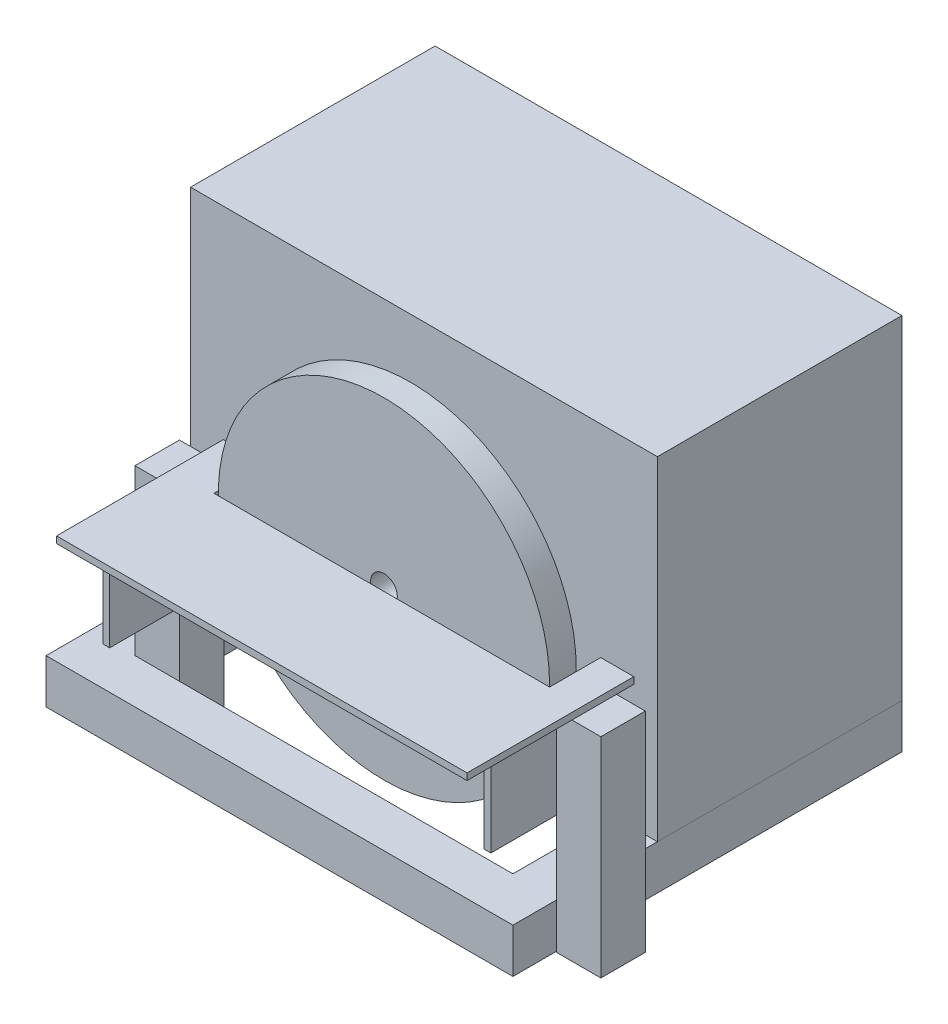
SolidWorks part; units mm, degrees
other "Tool Rest"
other "Plater"
other "Grinder Housing"
other "Base Frame"
ref_plane "Front Plane" through (0, 0, 0) normal (0, 0, 1) x (1, 0, 0)
ref_plane "Top Plane" through (0, 0, 0) normal (0, 1, 0) x (1, 0, 0)
ref_plane "Right Plane" through (0, 0, 0) normal (1, 0, 0) x (0, 0, -1)
sketch "Sketch1" plane through (0, 0, 0) normal (0, 1, 0) x (1, 0, 0)
  line L1 (-105, 87.5) -> (105, 87.5)
  line L2 (-105, 87.5) -> (-105, -87.5)
  line L3 (-105, -87.5) -> (105, -87.5)
  line L4 (105, 87.5) -> (105, -87.5)
  line L5 (-105, 87.5) -> (105, -87.5) construction
  line L6 (-105, -87.5) -> (105, 87.5) construction
  line L7 (85, 67.5) -> (85, -67.5)
  line L8 (-85, -67.5) -> (85, -67.5)
  line L9 (-85, 67.5) -> (-85, -67.5)
  line L10 (-85, 67.5) -> (85, 67.5) construction
  line L11 (-85, 67.5) -> (-85, 87.5)
  line L12 (85, 67.5) -> (85, 87.5)
  point P0 (0, 0)
  dimension "D1" = 210
  dimension "D2" = 175
  dimension "D3" = 20
extrude "Boss-Extrude1" add sketch "Sketch1" along normal blind 20 contours L12 L7 L8 L9 L11 L1 L2 L3 L4
sketch "Sketch2" plane through (0, 20, 0) normal (0, 1, 0) x (1, 0, 0)
  line L0 (105, 87.5) -> (105, -87.5) construction
  line L1 (-105, 87.5) -> (105, 87.5)
  line L2 (-105, 87.5) -> (-105, -22.5)
  line L3 (-105, -22.5) -> (105, -22.5)
  line L4 (105, 87.5) -> (105, -22.5)
  dimension "D1" = 110
extrude "Boss-Extrude2" add sketch "Sketch2" along normal blind 150 separate body
sketch "Sketch3" plane through (0, 0, 22.5) normal (0, 0, 1) x (1, 0, 0)
  line L0 (105, 170) -> (105, 20) construction
  line L1 (-105, 20) -> (105, 20) construction
  circle A0 centre (22, 97) radius 4
  point P6 (15.5507, 20)
  dimension "D3" = 8
  dimension "D1" = 83
  dimension "D2" = 77
extrude "Boss-Extrude3" add sketch "Sketch3" along normal blind 28
sketch "Sketch4" plane through (0, 0, 50.5) normal (0, 0, 1) x (1, 0, 0)
  circle A0 centre (22, 97) radius 18.5
  dimension "D1" = 37
extrude "Boss-Extrude4" add sketch "Sketch4" against normal blind 5
sketch "Sketch5" plane through (0, 0, 50.5) normal (0, 0, 1) x (1, 0, 0)
  circle A0 centre (22, 97) radius 6
  dimension "D1" = 12
extrude "Boss-Extrude5" add sketch "Sketch5" along normal blind 2 contours A0
sketch "Sketch6" plane through (0, 0, 50.5) normal (0, 0, 1) x (1, 0, 0)
  circle A0 centre (22, 97) radius 74.5
  circle A1 centre (22, 97) radius 6 construction
  circle A2 centre (22, 97) radius 6
  dimension "D1" = 149
extrude "Boss-Extrude6" add sketch "Sketch6" along normal blind 12 separate body
ref_plane "Plane1" through (0, 97, 0) normal (0, -1, 0) x (-1, 0, 0)
sketch "Sketch7" plane through (0, 97, 0) normal (0, -1, 0) x (-1, 0, 0)
  line L0 (-96.5, -62.5) -> (52.5, -62.5) construction
  line L1 (-96.5, -62.5) -> (52.5, -62.5) construction
  line L2 (-96.5, -50.5) -> (-96.5, -62.5) construction
  line L3 (52.5, -62.5) -> (52.5, -50.5) construction
  line L4 (-96.5, -50.5) -> (-96.5, -62.5) construction
  line L5 (52.5, -62.5) -> (52.5, -50.5) construction
  line L6 (-97.5, -50.5) -> (-97.5, -63.5)
  line L7 (-97.5, -63.5) -> (53.5, -63.5)
  line L8 (53.5, -63.5) -> (53.5, -50.5)
  line L9 (-97.5, -50.5) -> (-97.5, -40.5)
  line L10 (-97.5, -40.5) -> (-112.3768, -40.5)
  line L11 (-112.3768, -40.5) -> (-112.3768, -115.5)
  line L12 (-112.3768, -115.5) -> (72.2857, -115.5)
  line L13 (53.5, -50.5) -> (53.5, -40.5)
  line L14 (53.5, -40.5) -> (72.2857, -40.5)
  line L15 (72.2857, -40.5) -> (72.2857, -115.5)
  point P8 (65.8171, -119.5693)
  dimension "D2" = 75
  dimension "D3" = 10
  dimension "D1" = 1
extrude "Boss-Extrude7" add sketch "Sketch7" along normal blind 3 separate body
ref_plane "Plane2" through (102.3768, 0, 0) normal (1, 0, 0) x (0, 0, -1)
sketch "Sketch8" plane through (102.3768, 0, 0) normal (1, 0, 0) x (0, 0, -1)
  line L0 (-40.5, 94) -> (-115.5, 94) construction
  line L1 (-40.5, 94) -> (-115.5, 94)
  line L2 (-97.9831, 90.2829) -> (-79.8559, 90.2829) construction
  line L3 (-103.6638, 94) -> (-69.9632, 94)
  line L4 (-103.6638, 94) -> (-103.6638, 85.3713)
  line L5 (-103.6638, 85.3713) -> (-69.9632, 85.3713)
  line L6 (-69.9632, 94) -> (-69.9632, 85.3713)
  line L7 (-97.9831, 91.6256) -> (-79.8559, 91.6256)
  line L8 (-97.9831, 88.9402) -> (-79.8559, 88.9402)
  arc A0 (-97.9831, 91.6256) -> (-97.9831, 88.9402) centre (-97.9831, 90.2829) ccw
  arc A1 (-79.8559, 88.9402) -> (-79.8559, 91.6256) centre (-79.8559, 90.2829) ccw
  point P8 (-88.9195, 90.2829)
extrude "Boss-Extrude8" add sketch "Sketch8" against normal blind 3 contours L6 L1 L4 L5 A1 L8 A0 L7
sketch "Sketch9" plane through (102.3768, 0, 0) normal (1, 0, 0) x (0, 0, -1)
  line L0 (-69.9632, 94) -> (-103.6638, 94) construction
  line L1 (-97.7772, 94) -> (-53.6944, 94)
  line L2 (-97.7772, 94) -> (-97.7772, 53.422)
  line L3 (-97.7772, 53.422) -> (-53.6944, 53.422)
  line L5 (-53.6944, 53.422) -> (-38.4193, 53.422)
  line L6 (-38.4193, 53.422) -> (-38.4193, 74.4332)
  line L7 (-38.4193, 74.4332) -> (-53.6944, 74.4332)
  line L8 (-53.6944, 74.4332) -> (-53.6944, 94)
  circle A0 centre (-58.119, 88.9539) radius 2.4249
  point P8 (-57.8726, 86.0068)
  point P12 (0, 0)
  point P13 (0, 0)
  point P14 (-67.1876, 91.0014)
  point P15 (-58.119, 88.9539)
extrude "Boss-Extrude9" add sketch "Sketch9" along normal blind 3 separate body
sketch "Sketch10" plane through (105.3768, 0, 0) normal (1, 0, 0) x (0, 0, -1)
  line L0 (-53.6944, 94) -> (-97.7772, 94) construction
  line L1 (-68.3057, 94) -> (-48.3057, 94)
  line L2 (-68.3057, 94) -> (-68.3057, 0)
  line L3 (-68.3057, 0) -> (-48.3057, 0)
  line L4 (-48.3057, 94) -> (-48.3057, 0)
  dimension "D1" = 20
extrude "Boss-Extrude10" add sketch "Sketch10" along normal blind 20 separate body
sketch "Sketch11" plane through (-85, 0, 0) normal (1, 0, 0) x (0, 0, -1)
  line L1 (-67.5, 0) -> (-47.5, 0)
  line L2 (-67.5, 0) -> (-67.5, 94)
  line L3 (-67.5, 94) -> (-47.5, 94)
  line L4 (-47.5, 0) -> (-47.5, 94)
  line L6 (-115.5, 94) -> (-40.5, 94) construction
  line L7 (-115.5, 94) -> (-40.5, 94)
  dimension "D1" = 20
extrude "Boss-Extrude11" add sketch "Sketch11" along normal blind 20 separate body contours L4 L3 L2 M8 | L4 M6 M8 M9
sketch "Sketch12" plane through (-65, 0, 0) normal (1, 0, 0) x (0, 0, -1)
  line L1 (-101.9066, 94.7355) -> (-33.1172, 94.7355)
  line L2 (-101.9066, 94.7355) -> (-101.9066, 51.7251)
  line L3 (-101.9066, 51.7251) -> (-33.1172, 51.7251)
  line L4 (-33.1172, 94.7355) -> (-33.1172, 51.7251)
extrude "Boss-Extrude12" add sketch "Sketch12" along normal blind 3 separate body
sketch "Sketch13" plane through (-62, 0, 0) normal (1, 0, 0) x (0, 0, -1)
  line L0 (-91.1636, 91.8151) -> (-76.229, 91.8151) construction
  line L1 (-95.1817, 94.9746) -> (-72.6646, 94.9746)
  line L2 (-95.1817, 94.9746) -> (-95.1817, 87.6049)
  line L3 (-95.1817, 87.6049) -> (-72.6646, 87.6049)
  line L4 (-72.6646, 94.9746) -> (-72.6646, 87.6049)
  line L5 (-91.1636, 92.9774) -> (-76.229, 92.9774)
  line L6 (-91.1636, 90.6528) -> (-76.229, 90.6528)
  arc A0 (-91.1636, 92.9774) -> (-91.1636, 90.6528) centre (-91.1636, 91.8151) ccw
  arc A1 (-76.229, 90.6528) -> (-76.229, 92.9774) centre (-76.229, 91.8151) ccw
  point P6 (-83.6963, 91.8151)
extrude "Boss-Extrude13" add sketch "Sketch13" along normal blind 3 separate body
